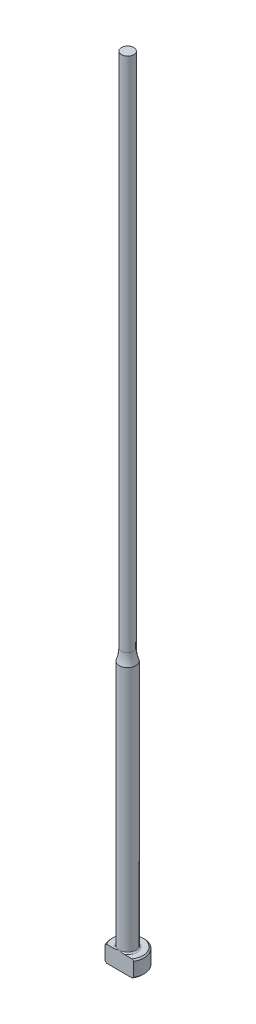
SolidWorks part; units mm, degrees
ref_plane "Front Plane" through (0, 0, 0) normal (0, 0, 1) x (1, 0, 0)
ref_plane "Top Plane" through (0, 0, 0) normal (0, 1, 0) x (1, 0, 0)
ref_plane "Right Plane" through (0, 0, 0) normal (1, 0, 0) x (0, 0, -1)
sketch "Sketch1" plane through (0, 0, 0) normal (0, 0, 1) x (1, 0, 0)
  line L0 (0, 259.9588) -> (0, -15.1925) construction
  line L1 (0, 0) -> (-3.175, 0)
  line L2 (-3.175, 0) -> (-3.175, 3.175)
  line L3 (-3.175, 3.175) -> (-1.5875, 3.175)
  line L4 (-1.19, 53.0114) -> (-1.19, 152.4)
  line L5 (-1.19, 152.4) -> (0, 152.4)
  line L6 (0, 152.4) -> (0, 0)
  line L7 (-1.5875, 3.175) -> (-1.5875, 50.8)
  arc A0 (-1.5875, 50.8) -> (-1.19, 53.0114) centre (-7.54, 53.0114) ccw
  point P13 (-1.5875, 0)
  dimension "D1" = 6.35
  dimension "L" = 152.4
  dimension "D2" = 3.175
  dimension "H" = 6.35
  dimension "T" = 3.175
  dimension "D" = 2.38
  dimension "S" = 50.8
revolve "Revolve1" add sketch "Sketch1" angle 360 about L0
chamfer "Chamfer1" distance 0.254 angle 45 2 edges at (0, 3.175, 3.175) (0, 0, 3.175)
fillet "Fillet1" radius 0.254 1 edges at (0, 3.175, 1.5875)
sketch "Sketch2" plane through (0, 0, 0) normal (0, -1, 0) x (1, 0, 0)
  line L0 (-2.7496, 1.5875) -> (2.7496, 1.5875)
  arc A0 (2.7496, 1.5875) -> (-2.7496, 1.5875) centre (0, 0) ccw
  circle A1 centre (0, 0) radius 3.175 construction
  circle A2 centre (0, 0) radius 1.5875 construction
extrude "Cut-Extrude1" cut sketch "Sketch2" against normal through all
